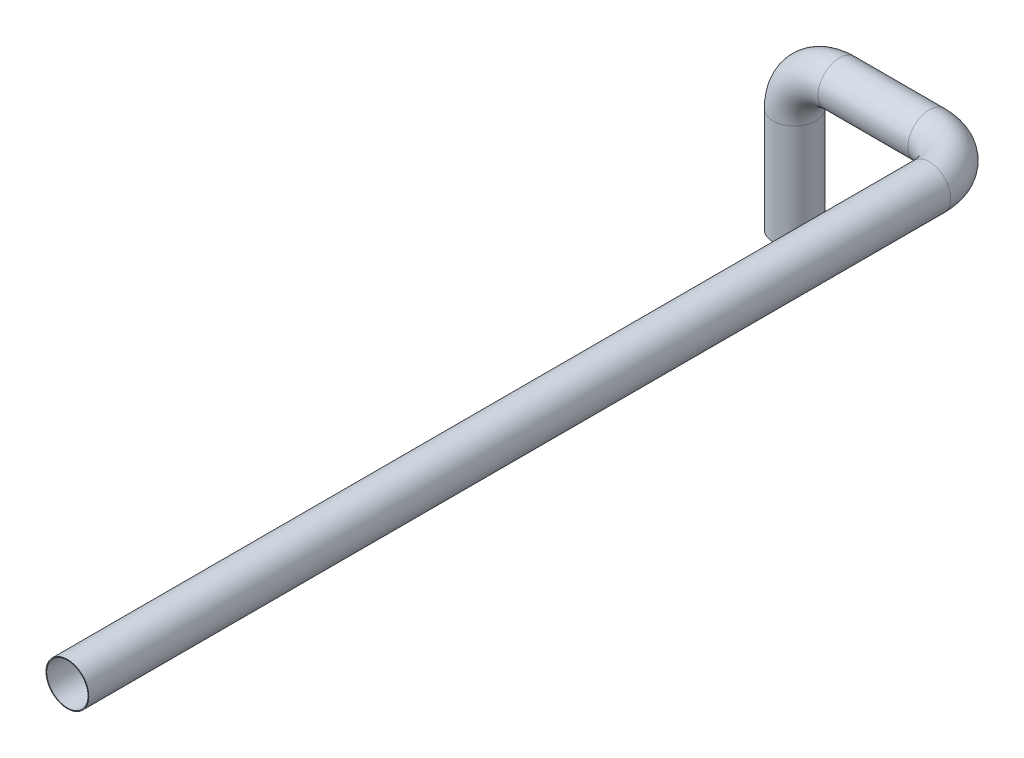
SolidWorks part; units mm, degrees
ref_plane "Alzado" through (0, 0, 0) normal (0, 0, 1) x (1, 0, 0)
ref_plane "Planta" through (0, 0, 0) normal (0, 1, 0) x (1, 0, 0)
ref_plane "Vista lateral" through (0, 0, 0) normal (1, 0, 0) x (0, 0, -1)
sketch3d "Croquis3D1"
  line L0 (30, 0, 0) -> (90, 0, 0)
  line L1 (120, 0, 30) -> (120, 0, 605.8)
  line L2 (0, -30, 0) -> (0, -100, 0)
  arc A0 (90, 0, 0) -> (120, 0, 30) centre (90, 0, 30) ccw
  arc A1 (30, 0, 0) -> (0, -30, 0) centre (30, -30, 0) ccw
  point P7 (120, 0, 0)
  point P8 (90, -30, 30)
  point P11 (0, 0, 0)
  point P12 (30, -30, 30)
  dimension "D4" = 30
  dimension "D1" = 120
  dimension "D2" = 605.8
  dimension "D3" = 100
ref_plane "Plano3" through (120, 0, 605.8) normal (0, 0, 1) x (1, 0, 0)
sketch "Croquis5" plane through (120, 0, 605.8) normal (0, 0, 1) x (1, 0, 0)
  circle A0 centre (0, 0) radius 14.3
  circle A1 centre (0, 0) radius 13.8
  dimension "D1" = 28.6
  dimension "D2" = 27.6
sweep "Barrer1" add profiles "Croquis5" path "Croquis3D1"
ref_plane "Plano4" through (0, -30, 0) normal (0, 1, 0) x (-1, 0, 0)
ref_plane "Plano5" through (90, 0, 0) normal (1, 0, 0) x (0, 0, -1)
